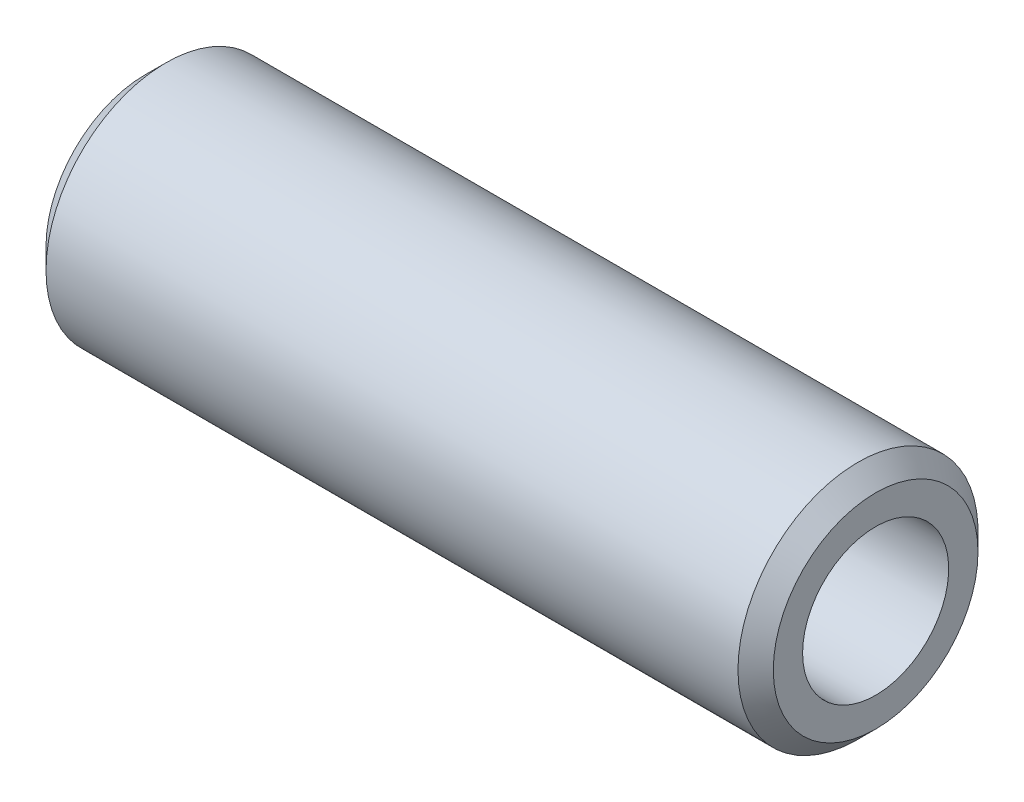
SolidWorks part; units mm, degrees
ref_plane "Plan de face" through (0, 0, 0) normal (0, 0, 1) x (1, 0, 0)
ref_plane "Plan de dessus" through (0, 0, 0) normal (0, 1, 0) x (1, 0, 0)
ref_plane "Plan de droite" through (0, 0, 0) normal (1, 0, 0) x (0, 0, -1)
sketch "Esquisse1" plane through (0, 0, 0) normal (0, 0, 1) x (1, 0, 0)
  line L0 (-47.1424, -1.549) -> (-30.6098, -1.549) construction
  line L1 (-176.3189, -1.549) -> (40.4049, -1.549) construction
  line L2 (-27.6354, 2.201) -> (-29.6354, 4.201) construction
  line L3 (-28.7891, 3.3548) -> (-29.6354, 4.201)
  line L6 (-29.6354, 4.201) -> (-62.7891, 4.201)
  line L7 (-63.7891, 3.201) -> (-63.7891, 1.951)
  line L8 (-63.7891, 1.951) -> (-28.7891, 1.951)
  line L9 (-28.7891, 1.951) -> (-28.7891, 3.3548)
  line L10 (-62.7891, 4.201) -> (-63.7891, 3.201)
  point P9 (-63.7891, 4.201)
  dimension "D1" = 7
  dimension "D2" = 1
  dimension "D3" = 45
  dimension "D4" = 35
revolve "Révolution1" add sketch "Esquisse1" angle 360 about L0
